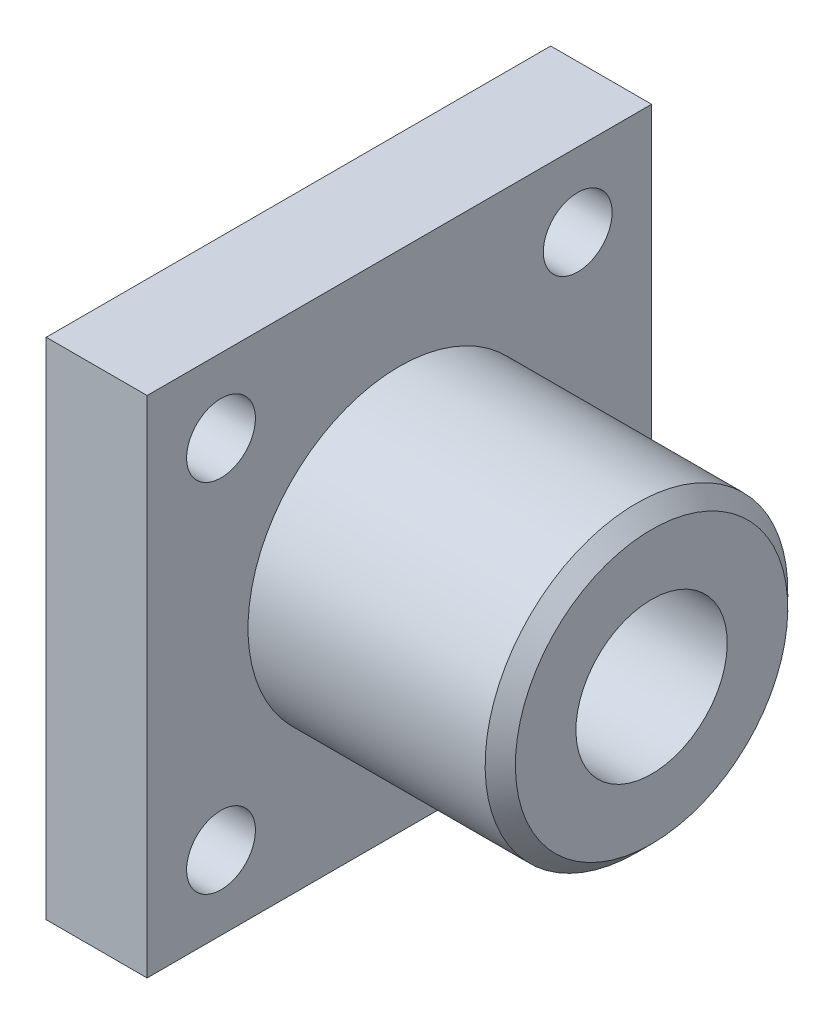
SolidWorks part; units mm, degrees
ref_plane "Front" through (0, 0, 0) normal (0, 0, 1) x (1, 0, 0)
ref_plane "Top" through (0, 0, 0) normal (0, 1, 0) x (1, 0, 0)
ref_plane "Right" through (0, 0, 0) normal (1, 0, 0) x (0, 0, -1)
sketch "Sketch1" plane through (0, 0, 0) normal (1, 0, 0) x (0, -1, 0)
  line L0 (127, -127) -> (-127, 127) construction
  line L1 (-127, 127) -> (127, 127)
  line L2 (-127, 127) -> (-127, -127)
  line L3 (-127, -127) -> (127, -127)
  line L4 (127, 127) -> (127, -127)
  dimension "D1" = 254
extrude "Extrude1" add sketch "Sketch1" along normal blind 50.8
sketch "Sketch2" plane through (50.8, 0, 0) normal (1, 0, 0) x (0, -1, 0)
  line L0 (0, 0) -> (-127, 127) construction
  line L1 (0, 0) -> (127, 127) construction
  line L2 (0, 0) -> (127, -127) construction
  line L3 (0, 0) -> (-127, -127) construction
  circle A0 centre (0, 0) radius 127 construction
  circle A1 centre (89.8026, 89.8026) radius 17.324
  circle A2 centre (-89.8026, 89.8026) radius 17.324
  circle A3 centre (-89.8026, -89.8026) radius 17.324
  circle A4 centre (89.8026, -89.8026) radius 17.324
  dimension "D1" = 254
extrude "Cut-Extrude1" cut sketch "Sketch2" against normal through all
sketch "Sketch3" plane through (50.8, 0, 0) normal (1, 0, 0) x (0, -1, 0)
  circle A0 centre (0, 0) radius 76.2
  dimension "D1" = 152.4
extrude "Extrude2" add sketch "Sketch3" along normal blind 127
chamfer "Chamfer1" distance 7.62 angle 45
sketch "Sketch4" plane through (177.8, 0, 0) normal (1, 0, 0) x (0, -1, 0)
  circle A0 centre (0, 0) radius 38.1
  dimension "D1" = 76.2
extrude "Cut-Extrude2" cut sketch "Sketch4" against normal through all
